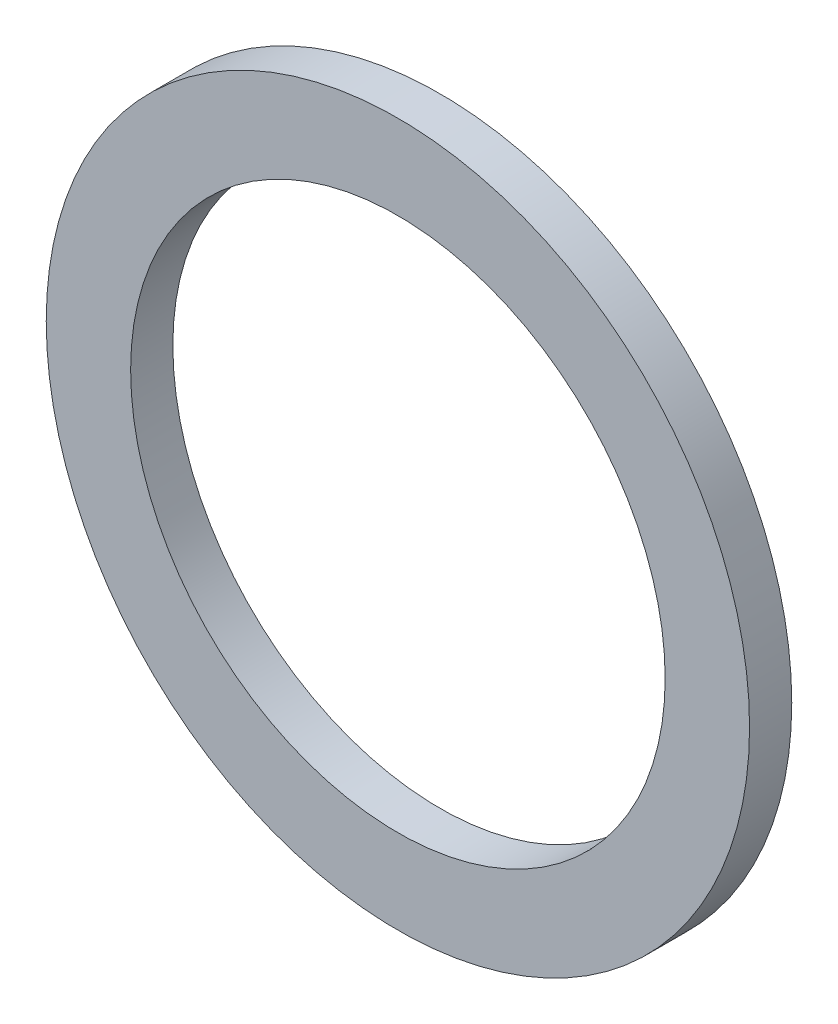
SolidWorks part; units mm, degrees
ref_plane "Front" through (0, 0, 0) normal (0, 0, 1) x (1, 0, 0)
ref_plane "Top" through (0, 0, 0) normal (0, 1, 0) x (1, 0, 0)
ref_plane "Right" through (0, 0, 0) normal (1, 0, 0) x (0, 0, -1)
sketch "Sketch1" plane through (0, 0, 0) normal (0, 0, 1) x (1, 0, 0)
  circle A0 centre (0, 0) radius 12.7
  circle A1 centre (0, 0) radius 9.652
  dimension "D1" = 25.4
  dimension "D2" = 19.304
extrude "Base-Extrude" add sketch "Sketch1" against normal blind 1.524
